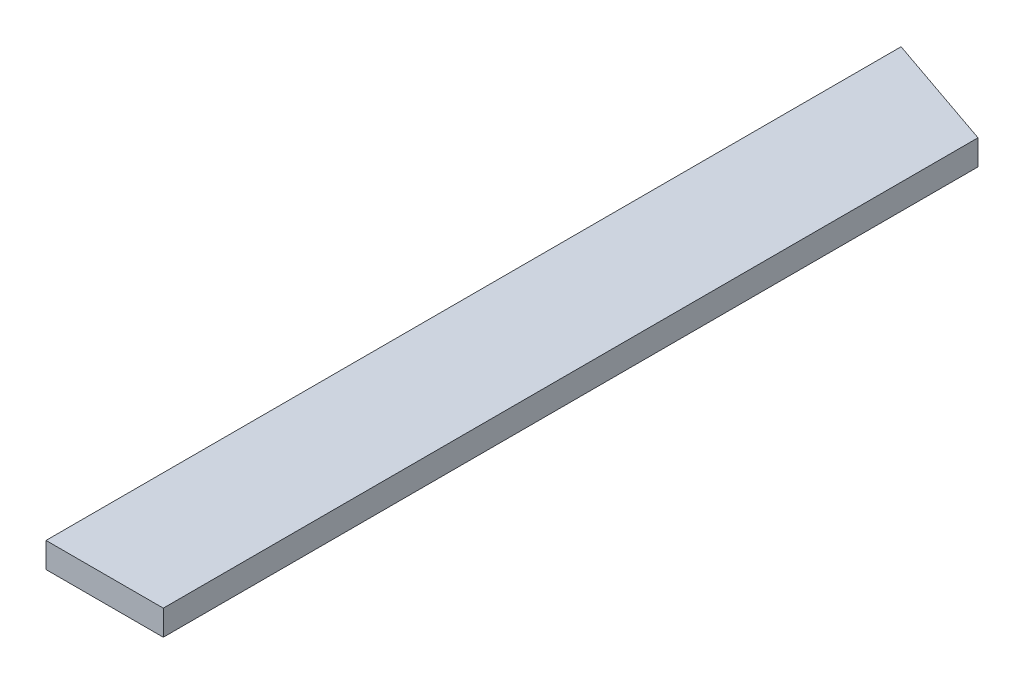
SolidWorks part; units mm, degrees
ref_plane "Front Plane" through (0, 0, 0) normal (0, 0, 1) x (1, 0, 0)
ref_plane "Top Plane" through (0, 0, 0) normal (0, 1, 0) x (1, 0, 0)
ref_plane "Right Plane" through (0, 0, 0) normal (1, 0, 0) x (0, 0, -1)
sketch "Sketch1" plane through (0, 0, 0) normal (0, 1, 0) x (1, 0, 0)
  line L1 (-295.275, 2361.3021) -> (295.275, 2361.3021)
  line L2 (-295.275, 2361.3021) -> (-295.275, -2361.3021)
  line L3 (-295.275, -2361.3021) -> (295.275, -2361.3021)
  line L4 (295.275, 2361.3021) -> (295.275, -2361.3021)
  line L5 (-295.275, 2361.3021) -> (295.275, -2361.3021) construction
  line L6 (-295.275, -2361.3021) -> (295.275, 2361.3021) construction
  point P0 (0, 0)
  dimension "D1" = 590.55
  dimension "D2" = 4722.6042
extrude "Boss-Extrude1" add sketch "Sketch1" along normal blind 127
sketch "Sketch2" plane through (0, 0, 0) normal (0, -1, 0) x (1, 0, 0)
  line L0 (-295.275, -1943.9198) -> (-295.275, -2361.3021)
  line L1 (-295.275, -2361.3021) -> (-295.275, 2361.3021) construction
  line L2 (-1507.4384, -2361.3011) -> (257.7502, -1753.4979) construction
  line L3 (-295.275, -2361.3021) -> (295.275, -2361.3021)
  line L4 (295.275, -2361.3021) -> (295.275, -1740.5771)
  line L5 (295.275, 2361.3021) -> (295.275, -2361.3021) construction
  line L6 (295.275, -1740.5771) -> (-295.275, -1943.9198)
extrude "Cut-Extrude1" cut sketch "Sketch2" against normal through all
